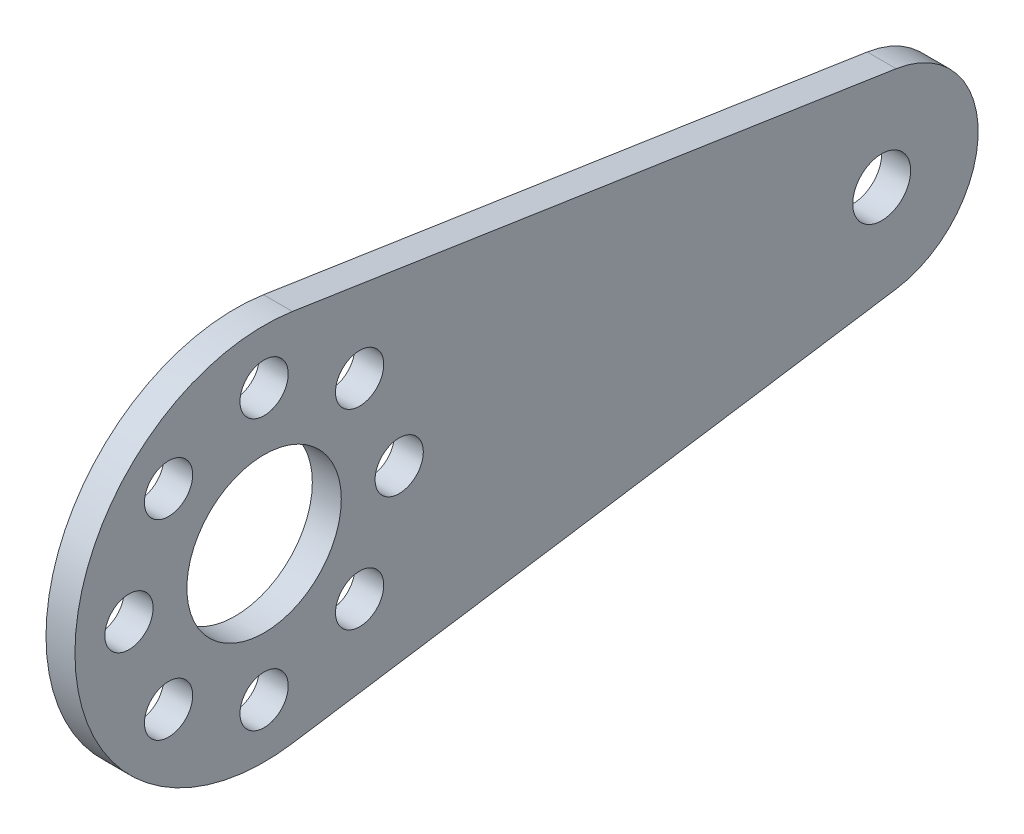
SolidWorks part; units mm, degrees
ref_plane "Front Plane" through (0, 0, 0) normal (0, 0, 1) x (1, 0, 0)
ref_plane "Top Plane" through (0, 0, 0) normal (0, 1, 0) x (1, 0, 0)
ref_plane "Right Plane" through (0, 0, 0) normal (1, 0, 0) x (0, 0, -1)
sketch "Sketch2" plane through (0, 0, 0) normal (1, 0, 0) x (0, 0, -1)
  line L0 (0, 0) -> (32, 0) construction
  line L1 (1.47, 9.6891) -> (32.75, 4.9434)
  line L2 (1.47, -9.6891) -> (32.75, -4.9434)
  line L3 (0, 0) -> (0, -7) construction
  line L4 (0, 0) -> (-4.9497, -4.9497) construction
  line L5 (0, 0) -> (-7, 0) construction
  line L6 (0, 0) -> (-4.9497, 4.9497) construction
  line L7 (0, 0) -> (0, 7) construction
  line L8 (0, 0) -> (4.9497, 4.9497) construction
  line L9 (0, 0) -> (7, 0) construction
  line L10 (0, 0) -> (4.9497, -4.9497) construction
  arc A0 (1.47, 9.6891) -> (1.47, -9.6891) centre (0, 0) ccw
  arc A1 (32.75, -4.9434) -> (32.75, 4.9434) centre (32, 0) ccw
  circle A2 centre (0, 0) radius 4
  circle A3 centre (32, 0) radius 1.5
  circle A4 centre (0, -7) radius 1.25
  circle A5 centre (-4.9497, -4.9497) radius 1.25
  circle A6 centre (-7, 0) radius 1.25
  circle A7 centre (-4.9497, 4.9497) radius 1.25
  circle A8 centre (0, 7) radius 1.25
  circle A9 centre (4.9497, 4.9497) radius 1.25
  circle A10 centre (7, 0) radius 1.25
  circle A11 centre (4.9497, -4.9497) radius 1.25
  point P28 (0, 0)
  dimension "D1" = 3
  dimension "D2" = 8
  dimension "D3" = 9.8
  dimension "D4" = 5
  dimension "D7" = 2.5
  dimension "D5" = 32
  dimension "D6" = 7
  dimension "D8" = 8
base flange "Base-Flange1" sketch "Sketch2" thickness 1.5 reverse thickness direction no parameters "D1"=1.65
sketch "Bend-Lines1" [suppressed] plane through (0, 0, 0) normal (0, 1, 0) x (1, 0, 0)
sketch "Bounding-Box1" [suppressed] plane through (0, 0, 0) normal (0, 1, 0) x (1, 0, 0)
sheet metal parameters "Sheet-Metal1" thickness 1.5 parameters "D1"=1.65
flat pattern "Flat-Pattern1"
sketch "Bend-Lines2" plane through (0, 0, 0) normal (0, 1, 0) x (1, 0, 0)
sketch3d "Bounding-Box2" [suppressed]
  line L0 (-8.219, -11.1591, 0) -> (37.6932, -4.1935, 0) construction
  line L1 (-11.159, 8.219, 0) -> (34.7532, 15.1847, 0) construction
  line L2 (-8.219, -11.1591, 0) -> (-11.159, 8.219, 0) construction
  line L3 (37.6932, -4.1935, 0) -> (34.7532, 15.1847, 0) construction
